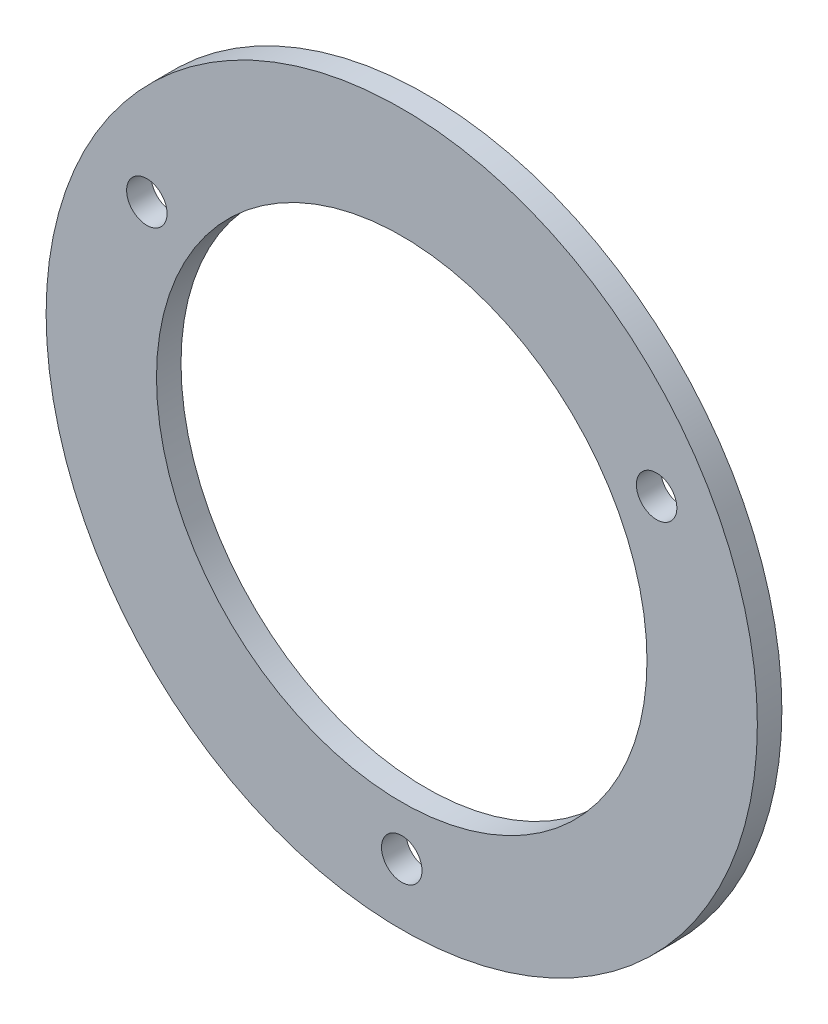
SolidWorks part; units mm, degrees
ref_plane "前视基准面" through (0, 0, 0) normal (0, 0, 1) x (1, 0, 0)
ref_plane "上视基准面" through (0, 0, 0) normal (0, 1, 0) x (1, 0, 0)
ref_plane "右视基准面" through (0, 0, 0) normal (1, 0, 0) x (0, 0, -1)
sketch "草图1" plane through (0, 0, 0) normal (0, 0, 1) x (1, 0, 0)
  circle A0 centre (-3, 52) radius 20
  circle A1 centre (-3, 52) radius 29
  circle A2 centre (-3, 52) radius 29 construction
  circle A3 centre (-3, 52) radius 20 construction
extrude "拉伸1" add sketch "草图1" along normal blind 2
hole_wizard "M4 螺纹孔1" positions "草图5" profile "草图4" tap size "M4" standard "ISO"
sketch "草图5" plane through (0, 0, 2) normal (0, 0, 1) x (1, 0, 0)
  point P1 (17.7846, 64)
  point P4 (-23.7846, 64)
  point P7 (-3, 28)
sketch "草图4" plane through (17.7846, 64, 2) normal (1, 0, 0) x (0, -1, 0)
  line L0 (0, 0) -> (0, 2)
  line L1 (0, 2) -> (1.65, 2)
  line L2 (1.65, 2) -> (1.65, 0)
  line L5 (1.65, 0) -> (0, 0)
  line L11 (0, -6.35) -> (0, 107.95) construction
  dimension "籵謂蹟恇謂郰芛眻噤" = 3.3
  dimension "籵謂蹟恇謂郰芛旮僅" = 2
